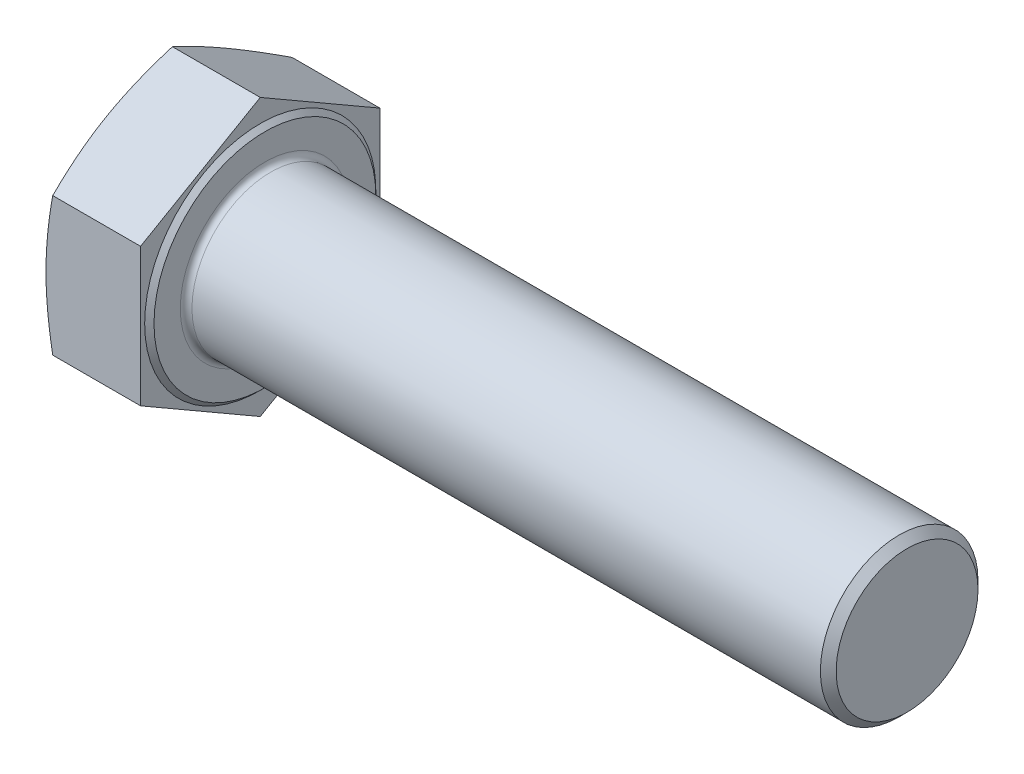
SolidWorks part; units mm, degrees
ref_plane "Front" through (0, 0, 0) normal (0, 0, 1) x (1, 0, 0)
ref_plane "Top" through (0, 0, 0) normal (0, 1, 0) x (1, 0, 0)
ref_plane "Right" through (0, 0, 0) normal (1, 0, 0) x (0, 0, -1)
sketch "Sketch2" plane through (0, 0, 0) normal (1, 0, 0) x (0, 0, -1)
  line L1 (0, -23.6714) -> (20.5, -11.8357)
  line L2 (20.5, -11.8357) -> (20.5, 11.8357)
  line L3 (20.5, 11.8357) -> (0, 23.6714)
  line L4 (0, 23.6714) -> (-20.5, 11.8357)
  line L5 (-20.5, 11.8357) -> (-20.5, -11.8357)
  line L6 (-20.5, -11.8357) -> (0, -23.6714)
  circle A0 centre (0, 0) radius 20.5 construction
  dimension "s" = 41
extrude "BaseHead" add sketch "Sketch2" along normal blind 17
sketch "Sketch3" plane through (0, 0, 0) normal (0, 0, 1) x (1, 0, 0)
  line L0 (17, 23.6714) -> (17, 19)
  line L2 (17, 19) -> (16.2, 19.8)
  line L3 (16.2, 19.8) -> (16.2, 23.6714)
  line L5 (16.2, 23.6714) -> (17, 23.6714)
  line L6 (-0.9571, 0) -> (7.6478, 0) construction
  line L7 (17, 23.6714) -> (0, 23.6714) construction
  dimension "D1" = 45
  dimension "c" = 0.8
  dimension "dw" = 38
revolve "BearingFace" cut sketch "Sketch3" angle 360 about L6
sketch "Sketch4" plane through (0, 0, 0) normal (0, 0, 1) x (1, 0, 0)
  line L0 (-0.4935, 0) -> (3.5626, 0) construction
  line L2 (0, 23.6714) -> (1.1543, 23.6714)
  line L4 (1.1543, 23.6714) -> (0, 20.5)
  line L6 (0, 20.5) -> (0, 23.6714)
  line L7 (16.2, 23.6714) -> (0, 23.6714) construction
  dimension "D1" = 20
  dimension "D2" = 41
revolve "HeadChamfer" cut sketch "Sketch4" angle 360 about L0
ref_plane "Plane1" through (67, 0, 0) normal (1, 0, 0) x (0, 0, -1)
sketch "Sketch5" plane through (17, 0, 0) normal (1, 0, 0) x (0, 0, -1)
  circle A0 centre (0, 0) radius 13.5
  dimension "d" = 27
extrude "BaseBody" add sketch "Sketch5" along normal blind 110
chamfer "Chamfer1" distance 1.35 angle 45 1 edges at (127, 0, -13.5)
fillet "HeadFillet" radius 1 1 edges at (17, 0, 13.5)
equation "\"D2@Sketch4\" = \"s@Sketch2\""
equation "\"D1@Chamfer1\" = 0.05 * \"d@Sketch5\""
equation "\"D1@ThreadCosmetic1\" = \"l@BaseBody\" - \"lg@Plane1\""
